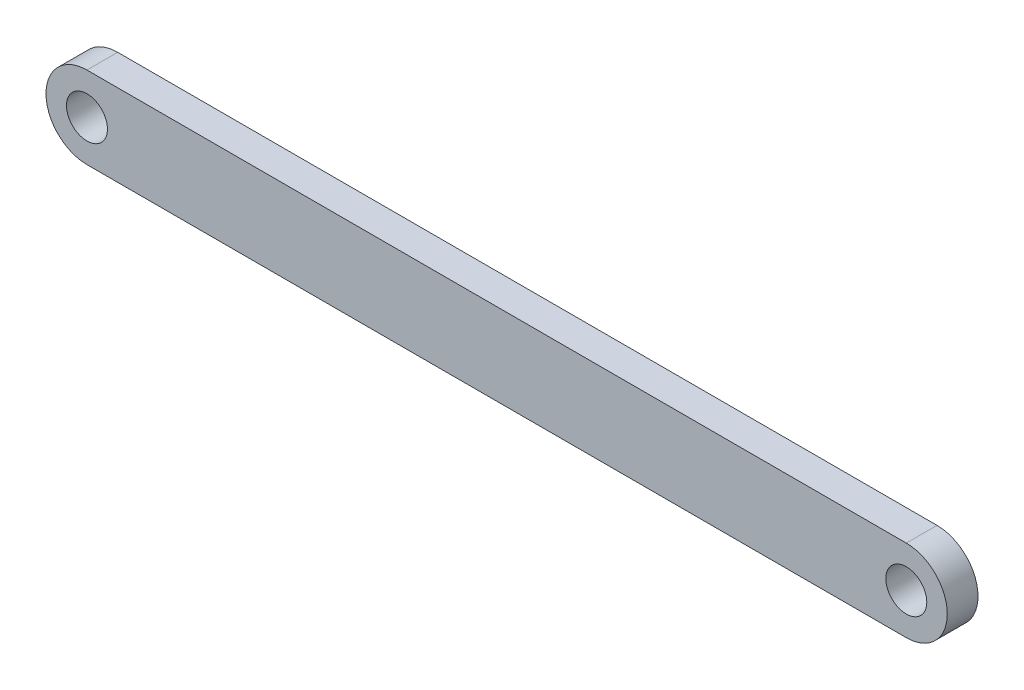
SolidWorks part; units mm, degrees
ref_plane "Front Plane" through (0, 0, 0) normal (0, 0, 1) x (1, 0, 0)
ref_plane "Top Plane" through (0, 0, 0) normal (0, 1, 0) x (1, 0, 0)
ref_plane "Right Plane" through (0, 0, 0) normal (1, 0, 0) x (0, 0, -1)
imported_body "Imported1"
sketch "Sketch1" plane through (0, 0, 3) normal (0, 0, 1) x (1, 0, 0)
  circle A0 centre (-65.045, -11.5842) radius 2
  circle A1 centre (14.955, -11.5842) radius 2
extrude "Cut-Extrude1" cut sketch "Sketch1" against normal blind 3
